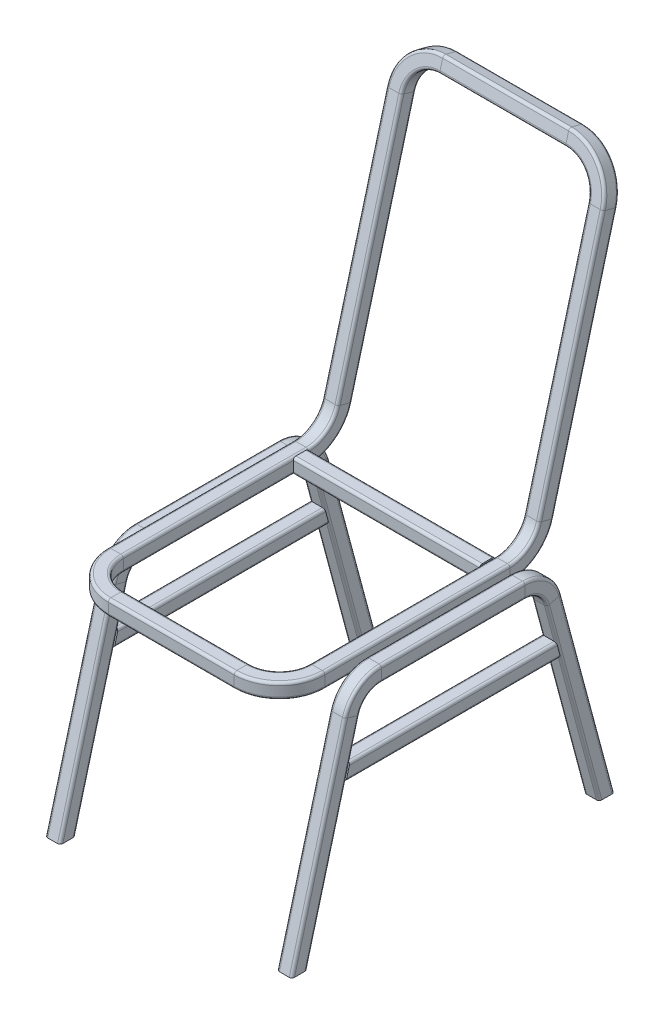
SolidWorks part; units mm, degrees
ref_plane "Front Plane" through (0, 0, 0) normal (0, 0, 1) x (1, 0, 0)
ref_plane "Top Plane" through (0, 0, 0) normal (0, 1, 0) x (1, 0, 0)
ref_plane "Right Plane" through (0, 0, 0) normal (1, 0, 0) x (0, 0, -1)
sketch3d "3DSketch1"
  line L0 (-200, 0, -192.4505) -> (200, 0, -192.4505)
  line L1 (-200, 0, 175) -> (-200, 0, -192.4505)
  line L2 (-125, 0, 250) -> (125, 0, 250)
  line L3 (200, 0, 175) -> (200, 0, -192.4505)
  line L4 (-200, 0, -250) -> (200, 0, -250) construction
  line L5 (-200, 0, 250) -> (200, 0, -250) construction
  line L6 (200, 0, 250) -> (-200, 0, -250) construction
  line L8 (-200, 55.5886, -264.8949) -> (-200, 527.5556, -391.3581)
  line L9 (-125, 600, -410.7695) -> (125, 600, -410.7695)
  line L10 (200, 55.5886, -264.8949) -> (200, 527.5556, -391.3581)
  arc A0 (-200, 527.5556, -391.3581) -> (-125, 600, -410.7695) centre (-125, 527.5556, -391.3581) ccw
  arc A1 (125, 0, 250) -> (200, 0, 175) centre (125, 0, 175) ccw
  arc A2 (-200, 0, 175) -> (-125, 0, 250) centre (-125, 0, 175) ccw
  arc A3 (125, 600, -410.7695) -> (200, 527.5556, -391.3581) centre (125, 527.5556, -391.3581) ccw
  arc A4 (200, 0, -192.4505) -> (200, 55.5886, -264.8949) centre (200, 75, -192.4505) ccw
  arc A5 (-200, 0, -192.4505) -> (-200, 55.5886, -264.8949) centre (-200, 75, -192.4505) ccw
  point P0 (0, 0, 0)
  point P12 (-200, 600, -410.7695)
  point P13 (-125, 508.1441, -463.8025)
  point P16 (200, 0, 250)
  point P18 (125, 75, 175)
  point P21 (-200, 0, 250)
  point P23 (-125, 75, 175)
  point P26 (200, 600, -410.7695)
  point P27 (125, 508.1441, -463.8025)
  point P30 (200, 0, -250)
  point P32 (275, 75, -192.4505)
  point P35 (-200, 0, -250)
  point P37 (-125, 75, -192.4505)
  dimension "D5" = 75
  dimension "D1" = 400
  dimension "D2" = 500
  dimension "D3" = 165
  dimension "D4" = 600
other "Tube (square) 30 X 30 X 2.6(1)"
ref_plane "Plane1" through (-200, 0, 175) normal (0, 0, -1) x (1, 0, 0)
sketch "Sketch1" plane through (-200, 0, 175) normal (0, 0, -1) x (1, 0, 0)
  line L0 (-9.8, -12.4) -> (9.8, -12.4)
  line L1 (-12.4, -9.8) -> (-12.4, 9.8)
  line L2 (9.8, 12.4) -> (-9.8, 12.4)
  line L3 (12.4, 9.8) -> (12.4, -9.8)
  line L4 (-9.8, -15) -> (9.8, -15)
  line L5 (-15, -9.8) -> (-15, 9.8)
  line L6 (9.8, 15) -> (-9.8, 15)
  line L7 (15, 9.8) -> (15, -9.8)
  line L8 (-15, 0) -> (-12.4, 0) construction
  line L9 (-12.4, 0) -> (12.4, 0) construction
  line L10 (12.4, 0) -> (15, 0) construction
  line L12 (0, 15) -> (0, 12.4) construction
  line L13 (0, 12.4) -> (0, -12.4) construction
  line L14 (0, -12.4) -> (0, -15) construction
  arc A0 (15, 9.8) -> (9.8, 15) centre (9.8, 9.8) ccw
  arc A1 (9.8, -15) -> (15, -9.8) centre (9.8, -9.8) ccw
  arc A2 (-15, -9.8) -> (-9.8, -15) centre (-9.8, -9.8) ccw
  arc A3 (-9.8, 15) -> (-15, 9.8) centre (-9.8, 9.8) ccw
  arc A4 (-9.8, 12.4) -> (-12.4, 9.8) centre (-9.8, 9.8) ccw
  arc A5 (12.4, 9.8) -> (9.8, 12.4) centre (9.8, 9.8) ccw
  arc A6 (9.8, -12.4) -> (12.4, -9.8) centre (9.8, -9.8) ccw
  arc A7 (-12.4, -9.8) -> (-9.8, -12.4) centre (-9.8, -9.8) ccw
  point P2 (-15, 15)
  point P33 (-15, -15)
  point P34 (15, -15)
  point P36 (15, 15)
  point P37 (0, 0)
  dimension "D1" = 5.2
  dimension "Thickness" = 2.6
  dimension "V_leg" = 30
  dimension "H_leg" = 30
sketch "Leg Layout" plane through (215, 0, 0) normal (1, 0, 0) x (0, 0, -1)
  line L0 (-270.5771, -450) -> (-164.8949, -55.5886)
  line L1 (-175, 0) -> (192.4505, 0) construction
  line L2 (-92.4505, 0) -> (192.4505, 0)
  line L3 (264.8949, -55.5886) -> (370.5771, -450)
  line L4 (370.5771, -450) -> (-270.5771, -450) construction
  line L5 (50, 0) -> (50, -450) construction
  line L6 (-190.1924, -150) -> (290.1924, -150)
  arc A0 (-164.8949, -55.5886) -> (-92.4505, 0) centre (-92.4505, -75) cw
  arc A1 (192.4505, 0) -> (264.8949, -55.5886) centre (192.4505, -75) cw
  point P13 (-150, 0)
  point P16 (250, 0)
  dimension "D5" = 75
  dimension "D1" = 400
  dimension "D2" = 15
  dimension "D3" = 150
  dimension "D4" = 450
other "Tube (square) 30 X 30 X 2.6(2)"
ref_plane "Plane2" through (215, -450, 270.5771) normal (0, 0.9659, -0.2588) x (0, 0.2588, 0.9659)
sketch "Sketch11" plane through (215, -450, 270.5771) normal (0, 0.9659, -0.2588) x (0, 0.2588, 0.9659)
  line L0 (-9.8, -12.4) -> (9.8, -12.4)
  line L1 (-12.4, -9.8) -> (-12.4, 9.8)
  line L2 (9.8, 12.4) -> (-9.8, 12.4)
  line L3 (12.4, 9.8) -> (12.4, -9.8)
  line L4 (-9.8, -15) -> (9.8, -15)
  line L5 (-15, -9.8) -> (-15, 9.8)
  line L6 (9.8, 15) -> (-9.8, 15)
  line L7 (15, 9.8) -> (15, -9.8)
  line L8 (-15, 0) -> (-12.4, 0) construction
  line L9 (-12.4, 0) -> (12.4, 0) construction
  line L10 (12.4, 0) -> (15, 0) construction
  line L12 (0, 15) -> (0, 12.4) construction
  line L13 (0, 12.4) -> (0, -12.4) construction
  line L14 (0, -12.4) -> (0, -15) construction
  arc A0 (15, 9.8) -> (9.8, 15) centre (9.8, 9.8) ccw
  arc A1 (9.8, -15) -> (15, -9.8) centre (9.8, -9.8) ccw
  arc A2 (-15, -9.8) -> (-9.8, -15) centre (-9.8, -9.8) ccw
  arc A3 (-9.8, 15) -> (-15, 9.8) centre (-9.8, 9.8) ccw
  arc A4 (-9.8, 12.4) -> (-12.4, 9.8) centre (-9.8, 9.8) ccw
  arc A5 (12.4, 9.8) -> (9.8, 12.4) centre (9.8, 9.8) ccw
  arc A6 (9.8, -12.4) -> (12.4, -9.8) centre (9.8, -9.8) ccw
  arc A7 (-12.4, -9.8) -> (-9.8, -12.4) centre (-9.8, -9.8) ccw
  point P2 (-15, 15)
  point P33 (-15, -15)
  point P34 (15, -15)
  point P36 (15, 15)
  point P37 (0, 0)
  dimension "D1" = 5.2
  dimension "Thickness" = 2.6
  dimension "V_leg" = 30
  dimension "H_leg" = 30
ref_plane "Bottom of Legs" through (0, -450, 0) normal (0, 1, 0) x (-1, 0, 0)
other "Trim/Extend1"
mirror "Mirror1" about plane through (0, 0, 0) normal (1, 0, 0)
